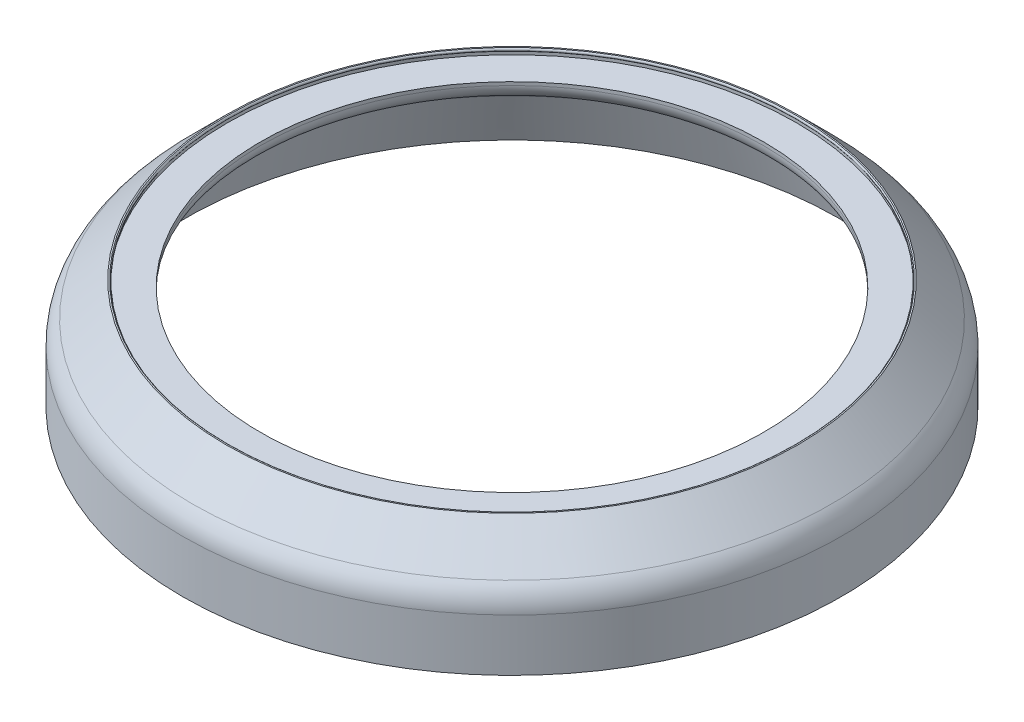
SolidWorks part; units mm, degrees
ref_plane "Front Plane" through (0, 0, 0) normal (0, 0, 1) x (1, 0, 0)
ref_plane "Top Plane" through (0, 0, 0) normal (0, 1, 0) x (1, 0, 0)
ref_plane "Right Plane" through (0, 0, 0) normal (1, 0, 0) x (0, 0, -1)
sketch "Sketch1" plane through (0, 0, 0) normal (0, 0, 1) x (1, 0, 0)
  line L0 (0, 0) -> (0, 84.8208) construction
  line L1 (-127, -39.8076) -> (-127, -14.4076)
  line L2 (-127, -14.4076) -> (-110.1725, 2.4199)
  line L3 (-109.2835, 1.838) -> (-108.2826, 1.838) construction
  line L4 (-109.6645, 1.178) -> (-109.6645, 0)
  line L5 (-111.2322, -7.62) -> (-96.9645, -7.62)
  line L6 (-111.2322, -7.62) -> (-120.65, -17.0378)
  line L7 (-120.65, -17.0378) -> (-120.65, -20.8487)
  line L8 (-120.65, -20.8487) -> (-125.73, -39.8076)
  line L9 (-96.9645, -7.62) -> (-96.9645, 0)
  line L10 (-96.9645, 0) -> (-109.6645, 0)
  line L11 (-127, -39.8076) -> (-125.73, -39.8076)
  line L13 (-109.6645, 2.4199) -> (-110.1725, 2.4199)
  line L14 (-109.9185, 1.838) -> (-112.1102, 1.838) construction
  line L16 (-109.5375, 1.27) -> (-109.5375, 0) construction
  arc A0 (-109.601, 1.288) -> (-109.6645, 2.4199) centre (-109.9185, 1.838) ccw
  arc A2 (-109.601, 1.288) -> (-109.6645, 1.178) centre (-109.5375, 1.178) ccw
  point P16 (-110.0455, 10.9745)
  dimension "D9" = 0.508
  dimension "D3" = 0.127
  dimension "D8" = 0.635
  dimension "D2" = 6.35
  dimension "D4" = 1.27
  dimension "D5" = 15
  dimension "D6" = 135
  dimension "D7" = 7.62
  dimension "D10" = 0.127
  dimension "D11" = 12.7
  dimension "D12" = 254
  dimension "D13" = 25.4
  dimension "D14" = 6.35
  dimension "D15" = 42.2275
  dimension "D16" = 0.381
revolve "Revolve1" add sketch "Sketch1" angle 360 about L0
fillet "Fillet1" radius 12.7 1 edges at (0, -14.4076, -127)
fillet "Fillet2" radius 6.35 4 edges at (0, -7.62, -96.9645) (0, -7.62, -111.2322) (0, -20.8487, -120.65) (0, -17.0378, -120.65)
